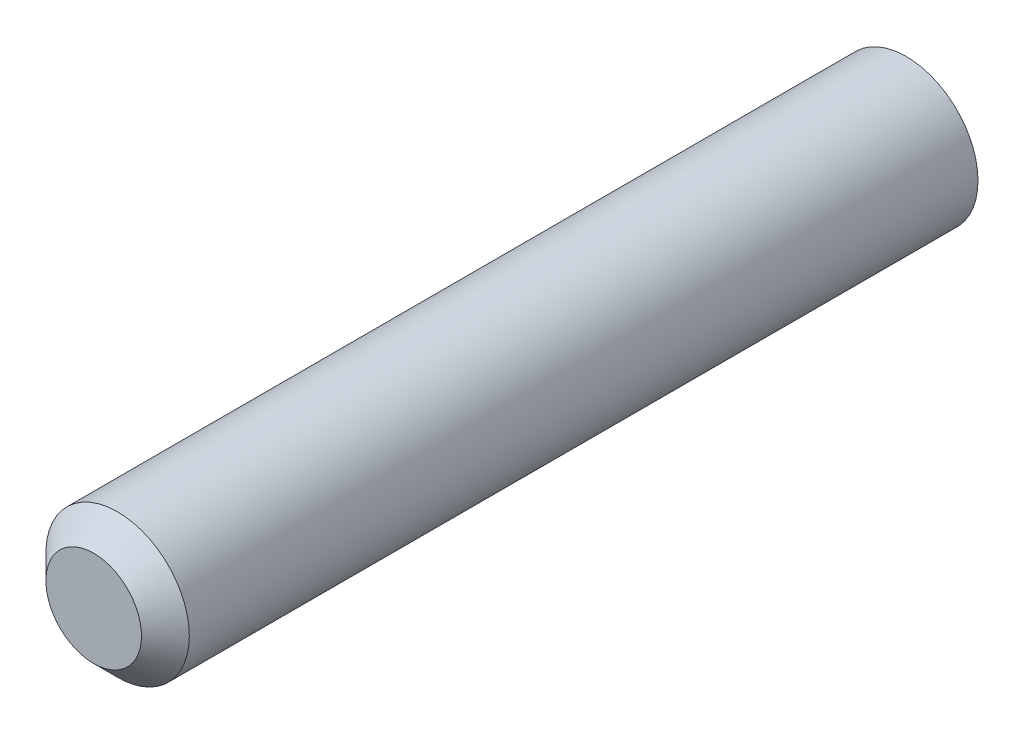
SolidWorks part; units mm, degrees
ref_plane "Frontal" through (0, 0, 0) normal (0, 0, 1) x (1, 0, 0)
ref_plane "Horizontal" through (0, 0, 0) normal (0, 1, 0) x (1, 0, 0)
ref_plane "Vertical" through (0, 0, 0) normal (1, 0, 0) x (0, 0, -1)
sketch "Esquisse1" plane through (0, 0, 0) normal (0, 0, 1) x (1, 0, 0)
  circle A0 centre (0, 0) radius 1.5
  dimension "D1" = 3
extrude "Extrusion1" add sketch "Esquisse1" along normal mid plane 17
chamfer "Chanfrein1" distance 0.5 angle 45 1 edges at (1.5, 0, 8.5)
